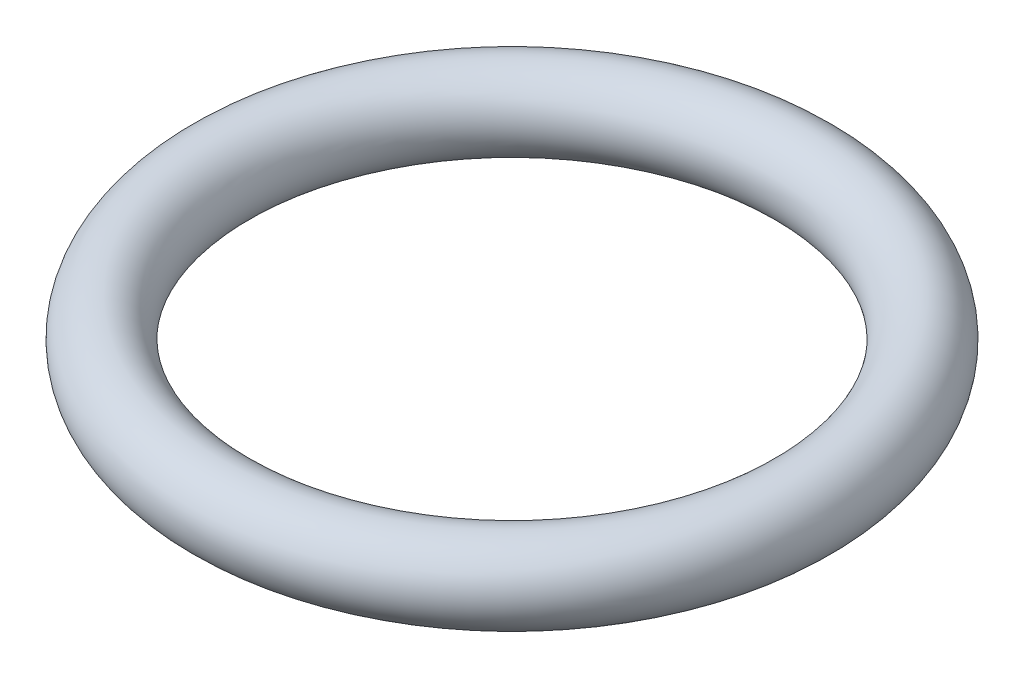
SolidWorks part; units mm, degrees
ref_plane "Plano frontal" through (0, 0, 0) normal (0, 0, 1) x (1, 0, 0)
ref_plane "Plano superior" through (0, 0, 0) normal (0, 1, 0) x (1, 0, 0)
ref_plane "Plano direito" through (0, 0, 0) normal (1, 0, 0) x (0, 0, -1)
sketch "Esboço1" plane through (0, 0, 0) normal (0, 0, 1) x (1, 0, 0)
  line L0 (0, 0) -> (5.55, 0) construction
  line L1 (0, 0) -> (0, 2) construction
  circle A0 centre (5.55, 0) radius 0.75
  dimension "D1" = 1.5
  dimension "D2" = 5.55
  dimension "D3" = 2
sketch "Esboço2" plane through (0, 0, 0) normal (1, 0, 0) x (0, 0, -1)
  line L1 (0, 0) -> (0, 1) construction
  point P0 (0, 0.5)
  dimension "D1" = 1
revolve "Revolução1" add sketch "Esboço1" angle 360 about L1
